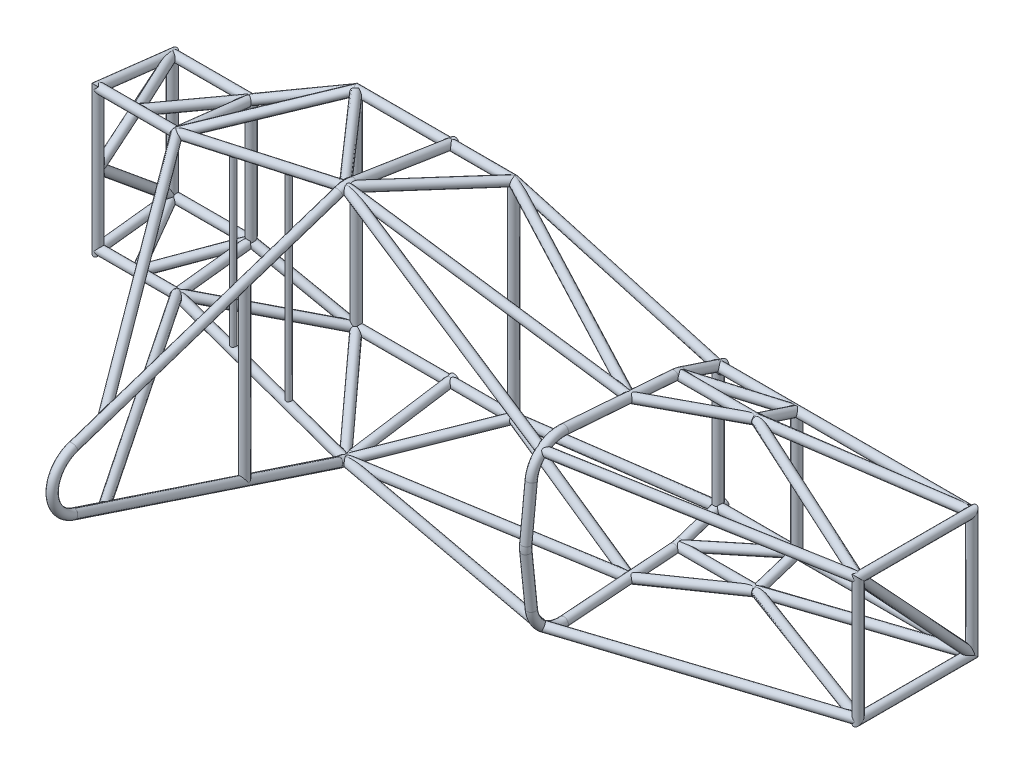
SolidWorks part; units mm, degrees
ref_plane "X-Y Datum" through (0, 0, 0) normal (0, 0, 1) x (1, 0, 0)
ref_plane "X-Z Datum" through (0, 0, 0) normal (0, 1, 0) x (1, 0, 0)
ref_plane "Y-Z Datum" through (0, 0, 0) normal (1, 0, 0) x (0, 0, -1)
sketch "Profile Sketch" plane through (0, 0, 0) normal (0, 1, 0) x (1, 0, 0)
  line L0 (1562.1, -47.625) -> (825.5, -47.625)
  line L1 (0, 0) -> (184.15, 0)
  line L2 (0, 0) -> (-520.9, 0)
  line L3 (-520.9, 0) -> (-520.9, -57.15)
  line L4 (-520.9, -57.15) -> (-749.5, -57.15)
  line L5 (1562.1, -47.625) -> (1562.1, -377.825)
  line L6 (825.5, -47.625) -> (825.5, -606.425)
  line L7 (0, 0) -> (0, -1155.7)
  line L8 (825.5, -47.625) -> (184.15, 0)
  line L9 (1562.1, -377.825) -> (825.5, -561.975)
  line L10 (1054.1, -47.625) -> (1054.1, -165.1)
  line L12 (832.5353, -616.9983) -> (7.0353, -1166.2733) construction
  line L16 (1562.1, -377.825) -> (1054.1, -165.1)
  line L17 (1054.1, -165.1) -> (825.5, -165.1)
  line L19 (-749.5, -57.15) -> (-749.5, -273.05)
  line L20 (567.1583, -41.1762) -> (288.9052, -20.5138) construction
  line L21 (-520.9, -57.15) -> (-520.9, -273.05)
  line L22 (-520.9, -273.05) -> (-749.5, -273.05)
  line L23 (137.3, -527.3369) -> (137.3, -807.3369) construction
  line L24 (425.3148, -130.9186) -> (137.3, -527.3369) construction
  line L25 (425.3148, -130.9186) -> (1337.7014, -200.025) construction
  line L26 (825.5, -304.8) -> (0, -304.8)
  line L27 (825.5, -304.8) -> (184.15, 0)
  line L28 (184.15, 0) -> (0, -304.8)
  line L29 (332.8527, -857.3901) -> (115.1249, -1002.2628) construction
  line L30 (825.5, -561.975) -> (0, -304.8)
  line L31 (0, -304.8) -> (-520.9, -273.05)
  line L32 (0, -304.8) -> (-273.05, 0)
  line L33 (-273.05, 0) -> (-520.9, -273.05)
  line L34 (-520.9, -273.05) -> (-11.0165, -1162.0187) construction
  line L35 (0, -609.6) -> (152.554, -630.3284) construction
  line L36 (55.4543, -966.1263) -> (-75.0666, -738.5664) construction
  line L37 (-520.9, -57.15) -> (-635.2, -273.05)
  line L38 (-635.2, -273.05) -> (-749.5, -57.15)
  line L39 (-520.9, 0) -> (-520.9, -273.05)
  line L40 (1562.1, -47.625) -> (1054.1, -165.1)
  line L41 (1054.1, -165.1) -> (825.5, -304.8)
  line L42 (1054.1, -47.625) -> (825.5, -165.1)
  line L43 (12.7, -1155.7) -> (12.7, 0) construction
  line L44 (0, -1005.7) -> (-520.9, -273.05)
  line L45 (0, -609.6) -> (-18.3492, -607.1068)
  line L46 (0, -609.6) -> (108.7542, -609.6) construction
  line L47 (-12.7, -1155.7) -> (-12.7, 0) construction
  line L48 (1562.1, -157.3) -> (1762.1, -157.3)
  line L49 (1762.1, -157.3) -> (1762.1, -257.3)
  line L50 (1762.1, -257.3) -> (1562.1, -257.3)
  circle A0 centre (184.15, 0) radius 12.7 construction
  circle A1 centre (-273.05, 0) radius 12.7 construction
  circle A2 centre (825.5, -606.425) radius 12.7 construction
  circle A3 centre (0, -1155.7) radius 12.7 construction
  circle A4 centre (137.3, -807.3369) radius 150 construction
  circle A5 centre (137.3, -527.3369) radius 100 construction
  circle A7 centre (425.3148, -130.9186) radius 100 construction
  circle A8 centre (0, -596.9) radius 12.7 construction
  circle A9 centre (-520.9, 0) radius 12.7 construction
  circle A10 centre (0, 0) radius 12.7 construction
  point P24 (171.45, 0)
  point P25 (-260.35, 0)
  point P28 (184.15, 0)
  point P52 (939.8, -165.1)
  point P54 (762.6, -47.625)
  point P55 (184.15, -12.7)
  point P62 (-635.2, -57.15)
  point P65 (1562.1, -157.3)
  point P66 (184.15, 12.7)
  dimension "D9" = 25.4
  dimension "D10" = 25.4
  dimension "D14" = 25.4
  dimension "D15" = 25.4
  dimension "D23" = 300
  dimension "D24" = 200
  dimension "D25" = 200
  dimension "D36" = 596.9
  dimension "D37" = 25.4
  dimension "D39" = 25.4
  dimension "D43" = 200
  dimension "D1" = 736.6
  dimension "D3" = 184.15
  dimension "D5" = 330.2
  dimension "D6" = 558.8
  dimension "D7" = 44.45
  dimension "D8" = 47.625
  dimension "D11" = 228.6
  dimension "D12" = 117.475
  dimension "D13" = 1155.7
  dimension "D16" = 431.8
  dimension "D17" = 57.15
  dimension "D18" = 641.35
  dimension "D19" = 12.7
  dimension "D20" = 1575
  dimension "D21" = 228.6
  dimension "D22" = 273.05
  dimension "D26" = 280
  dimension "D27" = 490
  dimension "D28" = 54
  dimension "D29" = 915
  dimension "D30" = 304.8
  dimension "D31" = 304.8
  dimension "D32" = 76.6683
  dimension "D33" = 150
  dimension "D34" = 155.1234
  dimension "D35" = 7.738
  dimension "D38" = 152.4
  dimension "D40" = 520.9
  dimension "D41" = 170
  dimension "D42" = 35.412
  dimension "D44" = 100
  dimension "D45" = 825.5
ref_plane "Front Bulkhead Plane" through (1562.1, 0, 0) normal (1, 0, 0) x (0, 0, -1)
ref_plane "Front Suspension Plane" through (1054.1, 0, 0) normal (1, 0, 0) x (0, 0, -1)
ref_plane "Front Hoop Plane" through (825.5, 0, 0) normal (1, 0, 0) x (0, 0, -1)
ref_plane "AC Front Tube Plane" through (184.15, 0, 0) normal (1, 0, 0) x (0, 0, -1)
ref_plane "Main Hoop Plane" through (0, 0, 0) normal (1, 0, 0) x (0, 0, -1)
ref_plane "AC Rear Mounting Tube Plane" through (-273.05, 0, 0) normal (1, 0, 0) x (0, 0, -1)
ref_plane "Rear Suspension Plane" through (-520.9, 0, 0) normal (1, 0, 0) x (0, 0, -1)
ref_plane "Rear Bulkhead Plane" through (-749.5, 0, 0) normal (1, 0, 0) x (0, 0, -1)
sketch "Front Bulkhead Sketch" plane through (1562.1, 0, 0) normal (1, 0, 0) x (0, 0, -1)
  line L0 (-47.625, -177.8) -> (-47.625, 177.8)
  line L1 (-47.625, -177.8) -> (-377.825, 177.8)
  line L2 (-377.825, -177.8) -> (-377.825, 177.8)
  line L4 (-47.625, 177.8) -> (-377.825, 177.8)
  line L5 (-47.625, -177.8) -> (-377.825, -177.8)
  line L6 (-47.625, 177.8) -> (-47.625, 193.675)
  line L7 (-377.825, 177.8) -> (-377.825, 193.675)
  line L8 (649.605, 0) -> (-649.605, 0) construction
  line L9 (-47.625, -177.8) -> (-47.625, -193.675)
  line L10 (-377.825, -177.8) -> (-377.825, -193.675)
  point P4 (-47.625, 0)
  point P9 (-377.825, 0)
  dimension "D1" = 355.6
  dimension "D2" = 15.875
  dimension "D3" = 15.875
  dimension "D4" = 330.2
sketch "Front Suspension Sketch" plane through (1054.1, 0, 0) normal (1, 0, 0) x (0, 0, -1)
  line L0 (-47.625, -177.8) -> (-47.625, 177.8)
  line L2 (-47.625, 177.8) -> (-165.1, 215.9)
  line L3 (-47.625, -177.8) -> (-165.1, -215.9)
  point P4 (-47.625, 0)
  dimension "D1" = 355.6
  dimension "D2" = 431.8
  dimension "D3" = 117.475
  dimension "D4" = 72.031
sketch "Front Hoop Sketch" plane through (825.5, 0, 0) normal (1, 0, 0) x (0, 0, -1)
  line L0 (-47.625, -177.8) -> (-47.625, 177.8)
  line L1 (-47.625, 177.8) -> (-154.605, 213.1317)
  line L2 (-47.625, -177.8) -> (-154.605, -213.1317)
  line L3 (-175.8541, 217.3687) -> (-495.1303, 241.2472)
  line L4 (-175.8541, -217.3687) -> (-495.1303, -241.2472)
  line L6 (-590.1899, 161.7303) -> (-605.9544, 9.1356)
  line L8 (-590.1899, -161.7303) -> (-605.9544, -9.1356)
  line L9 (-304.8, -227.0125) -> (-304.8, 227.0125) construction
  line L10 (-165.1, -215.9) -> (-165.1, 215.9) construction
  line L11 (-558.8, -220.7835) -> (-558.8, 220.7835) construction
  line L12 (-47.625, 177.8) -> (-29.536, 171.8258)
  line L13 (-47.625, -177.8) -> (-29.536, -171.8258)
  arc A1 (-154.605, -213.1317) -> (-175.8541, -217.3687) centre (-182.4844, -128.7163) cw
  arc A2 (-154.605, 213.1317) -> (-175.8541, 217.3687) centre (-182.4844, 128.7163) ccw
  arc A5 (-495.1303, 241.2472) -> (-590.1899, 161.7303) centre (-501.7605, 152.5947) ccw
  arc A6 (-605.9544, 9.1356) -> (-605.9544, -9.1356) centre (-517.525, 0) ccw
  arc A7 (-495.1303, -241.2472) -> (-590.1899, -161.7303) centre (-501.7605, -152.5947) cw
  point P4 (-47.625, 0)
  point P13 (-606.425, 0)
  point P17 (-164.9695, -216.5547)
  point P27 (-606.425, 0)
  point P35 (-304.8, 0)
  point P40 (-606.425, 0)
  point P44 (-165.1, 215.9)
  point P46 (-165.1, -215.9)
  dimension "D3" = 88.9
  dimension "D6" = 117.475
  dimension "D10" = 88.9
  dimension "D11" = 454.025
  dimension "D7" = 88.9
  dimension "D2" = 431.8
  dimension "D1" = 355.6
  dimension "D4" = 215.9
  dimension "D5" = 47.625
  dimension "D8" = 19.05
  dimension "D9" = 19.05
  dimension "D12" = 441.567
sketch "AC Front Tube Sketch" plane through (184.15, 0, 0) normal (1, 0, 0) x (0, 0, -1)
  line L0 (0, -298.45) -> (0, 298.45)
  line L1 (0, 298.45) -> (0, 317.5)
  line L2 (0, -298.45) -> (0, -317.5)
  point P4 (0, 0)
  dimension "D1" = 596.9
  dimension "D2" = 19.05
  dimension "D3" = 19.05
sketch "Main Hoop Sketch" plane through (0, 0, 0) normal (1, 0, 0) x (0, 0, -1)
  line L0 (0, -298.45) -> (0, 298.45) construction
  line L1 (-1005.7, 113.8912) -> (-1005.7, -113.8912) construction
  line L2 (-304.8, -346.075) -> (-304.8, 346.075) construction
  line L3 (0, -298.45) -> (12.5478, -296.4894)
  line L4 (0, -298.45) -> (-283.5434, -342.7537)
  line L5 (0, 298.45) -> (-283.5434, 342.7537)
  line L6 (-325.2231, 339.3095) -> (-1094.7555, 84.3902)
  line L8 (0, 298.45) -> (12.5478, 296.4894)
  line L9 (0, 0) -> (-1155.7, 0) construction
  line L10 (-325.2231, -339.3095) -> (-1094.7555, -84.3902)
  line L13 (-596.9, -249.3124) -> (-596.9, 249.3124)
  arc A0 (-1094.7555, 84.3902) -> (-1094.7555, -84.3902) centre (-1066.8, 0) ccw
  arc A1 (-325.2231, -339.3095) -> (-283.5434, -342.7537) centre (-297.2675, -254.9194) ccw
  arc A2 (-325.2231, 339.3095) -> (-283.5434, 342.7537) centre (-297.2675, 254.9194) cw
  point P4 (0, 0)
  point P7 (-304.8, 0)
  point P9 (-304.5887, 343.5174)
  point P15 (-1349.5065, 0)
  point P29 (-1005.7, 0)
  point P30 (-1155.7, 0)
  point P34 (-596.9, 0)
  point P41 (-304.5887, -343.5174)
  dimension "D2" = 692.15
  dimension "D5" = 88.9
  dimension "D7" = 88.9
  dimension "D8" = 88.9
  dimension "D1" = 596.9
  dimension "D3" = 12.7
  dimension "D4" = 12.7
  dimension "D6" = 687.0348
sketch "AC Rear Mounting Sketch" plane through (-273.05, 0, 0) normal (1, 0, 0) x (0, 0, -1)
  line L0 (0, -298.45) -> (0, -317.5) construction
  line L1 (0, 298.45) -> (0, 317.5) construction
  line L2 (0, -298.45) -> (0, 298.45) construction
  line L3 (0, -298.45) -> (0, -317.5)
  line L4 (0, 298.45) -> (0, 317.5)
  line L5 (0, -298.45) -> (0, 298.45)
  point P4 (0, 0)
sketch "Rear Suspension Sketch" plane through (-520.9, 0, 0) normal (1, 0, 0) x (0, 0, -1)
  line L0 (-57.15, -177.8) -> (-57.15, 177.8)
  line L12 (-57.15, -177.8) -> (-273.05, -202.9047)
  line L13 (-57.15, 177.8) -> (-273.05, 202.9047)
  line L14 (-166.37, -190.5) -> (-166.37, 190.5) construction
  line L16 (-273.05, -202.9047) -> (-273.05, 202.9047) construction
  point P0 (-273.05, 0)
  point P4 (-57.15, 0)
  point P25 (-166.37, 0)
  dimension "D2" = 190.5
  dimension "D5" = 83.367
  dimension "D1" = 355.6
  dimension "D8" = 381
  dimension "D9" = 109.22
sketch "Rear Bulkhead Sketch" plane through (-749.5, 0, 0) normal (1, 0, 0) x (0, 0, -1)
  line L0 (-273.05, -202.9047) -> (-273.05, 202.9047) construction
  line L4 (-57.15, -177.8) -> (-57.15, 177.8) construction
  line L11 (-57.15, -177.8) -> (-273.05, -202.9047) construction
  line L13 (-57.15, -177.8) -> (-57.15, 177.8)
  line L16 (-57.15, -177.8) -> (-273.05, 0)
  line L17 (-273.05, 0) -> (-57.15, 177.8)
  line L18 (-57.15, 177.8) -> (-273.05, 202.9047) construction
  line L20 (-273.05, -202.9047) -> (-273.05, 202.9047)
  line L21 (-57.15, -177.8) -> (-273.05, -202.9047)
  line L23 (-57.15, 177.8) -> (-273.05, 202.9047)
sketch3d "3DSketch1"
  line L0 (1562.1, 177.8, 47.625) -> (825.5, 177.8, 47.625)
  line L1 (825.5, -177.8, 47.625) -> (1562.1, -177.8, 47.625)
  line L2 (-273.05, 298.45, 0) -> (-520.9, 177.8, 57.15)
  line L3 (-273.05, -298.45, 0) -> (-520.9, -177.8, 57.15)
  line L4 (1054.1, 215.9, 165.1) -> (825.5, 215.9, 165.1)
  line L5 (1054.1, -215.9, 165.1) -> (1562.1, -177.8, 47.625)
  line L6 (1054.1, -215.9, 165.1) -> (1562.1, -177.8, 377.825)
  line L7 (825.5, -220.7835, 558.8) -> (1562.1, -177.8, 377.825)
  line L8 (825.5, -215.9, 165.1) -> (1054.1, -215.9, 165.1)
  line L9 (1562.1, 177.8, 377.825) -> (825.5, 220.7835, 558.8)
  line L10 (1562.1, 177.8, 47.625) -> (1054.1, 215.9, 165.1)
  line L11 (825.5, -215.9, 165.1) -> (1054.1, -177.8, 47.625)
  line L12 (1054.1, 177.8, 47.625) -> (825.5, 215.9, 165.1)
  line L13 (1562.1, 177.8, 377.825) -> (1054.1, 215.9, 165.1)
  line L14 (825.5, 177.8, 47.625) -> (184.15, 298.45, 0)
  line L15 (184.15, 298.45, 0) -> (0, 298.45, 0)
  line L17 (825.5, 227.0125, 304.8) -> (184.15, 298.45, 0)
  line L19 (184.15, -298.45, 0) -> (825.5, -177.8, 47.625)
  line L20 (0, -298.45, 0) -> (184.15, -298.45, 0)
  line L21 (184.15, -298.45, 0) -> (825.5, -227.0125, 304.8)
  line L24 (184.15, 298.45, 0) -> (0, 343.5174, 304.5887)
  line L25 (825.5, 227.0125, 304.8) -> (0, 343.5174, 304.5887)
  line L26 (825.5, 220.7835, 558.8) -> (0, 343.5174, 304.5887)
  line L27 (0, -343.5174, 304.5887) -> (825.5, -227.0125, 304.8)
  line L28 (184.15, -298.45, 0) -> (0, -343.5174, 304.5887)
  line L29 (0, -343.5174, 304.5887) -> (825.5, -220.7835, 558.8)
  line L30 (0, 298.45, 0) -> (-273.05, 298.45, 0)
  line L31 (-273.05, -298.45, 0) -> (0, -298.45, 0)
  line L32 (-520.9, 202.9047, 273.05) -> (-749.5, 202.9047, 273.05)
  line L33 (-749.5, -202.9047, 273.05) -> (-520.9, -202.9047, 273.05)
  line L34 (0, 343.5174, 304.5887) -> (-520.9, 202.9047, 273.05)
  line L35 (0, -343.5174, 304.5887) -> (-520.9, -202.9047, 273.05)
  line L36 (-520.9, 177.8, 57.15) -> (-749.5, 177.8, 57.15)
  line L37 (0, 343.5174, 304.5887) -> (-273.05, 298.45, 0)
  line L38 (-273.05, 298.45, 0) -> (-520.9, 202.9047, 273.05)
  line L42 (-520.9, -202.9047, 273.05) -> (-273.05, -298.45, 0)
  line L43 (-273.05, -298.45, 0) -> (0, -343.5174, 304.5887)
  line L44 (-749.5, -177.8, 57.15) -> (-520.9, -177.8, 57.15)
  line L45 (-749.5, -177.8, 57.15) -> (-635.2, -202.9047, 273.05)
  line L49 (0, -113.8912, 1005.7) -> (-520.9, -202.9047, 273.05)
  line L50 (1054.1, 215.9, 165.1) -> (825.5, 227.0125, 304.8)
  line L51 (1054.1, -215.9, 165.1) -> (825.5, -227.0125, 304.8)
  line L52 (-175.0354, 296.268, 293.9909) -> (-175.0354, -296.268, 293.9909)
  line L53 (-346.3986, 250.0099, 283.6154) -> (-346.3986, -250.0099, 283.6154)
  line L54 (0, 113.8912, 1005.7) -> (-520.9, 202.9047, 273.05)
  line L55 (-635.2, -202.9047, 273.05) -> (-520.9, -177.8, 57.15)
  line L56 (-520.9, 177.8, 57.15) -> (-635.2, 202.9047, 273.05)
  line L57 (-635.2, 202.9047, 273.05) -> (-749.5, 177.8, 57.15)
  line L58 (-749.5, 202.9047, 273.05) -> (-768.55, 202.9047, 273.05)
  line L59 (-749.5, 177.8, 57.15) -> (-768.55, 177.8, 57.15)
  line L60 (-749.5, -177.8, 57.15) -> (-768.55, -177.8, 57.15)
  line L61 (-749.5, -202.9047, 273.05) -> (-768.55, -202.9047, 273.05)
  line L62 (1562.1, -177.8, 377.825) -> (825.5, 220.7835, 558.8)
  line L64 (-520.9, 177.8, 57.15) -> (-463.75, 177.8, 57.15)
  line L65 (-520.9, -177.8, 57.15) -> (-463.75, -177.8, 57.15)
  line L66 (825.5, -177.8, 47.625) -> (1054.1, 177.8, 47.625)
  line L67 (-273.05, -298.45, 0) -> (-273.05, 298.45, 0)
  point P24 (-175.0354, 296.268, 293.9909)
  point P33 (0, 343.5174, 304.5887)
  point P44 (0, -343.5174, 304.5887)
  point P54 (-346.3986, 250.0099, 283.6154)
  dimension "D1" = 181.61
  dimension "D2" = 177.8
  dimension "D3" = 19.05
  dimension "D4" = 57.15
  dimension "D5" = 57.15
other "Round_tubing 1.00 X 0.095IN(1)"
ref_plane "Plane8" through (825.5, 177.8, 47.625) normal (0, -0.3136, -0.9496) x (0, 0.9496, -0.3136)
sketch "Sketch15" plane through (825.5, 177.8, 47.625) normal (0, -0.3136, -0.9496) x (0, 0.9496, -0.3136)
  circle A0 centre (0, 0) radius 12.7
  circle A1 centre (0, 0) radius 10.287
  point P4 (0, 0)
  dimension "D1" = 25.4
  dimension "D2" = 2.413
other "Round_tubing 1.00 X 0.049IN(22)"
ref_plane "Plane37" through (1562.1, -177.8, 377.825) normal (-0.8597, 0.4652, 0.2112) x (0.3899, 0.3302, 0.8597)
sketch "Sketch152" plane through (1562.1, -177.8, 377.825) normal (-0.8597, 0.4652, 0.2112) x (0.3899, 0.3302, 0.8597)
  circle A0 centre (0, 0) radius 12.7
  circle A1 centre (0, 0) radius 11.4554
  point P4 (0, 0)
  dimension "D1" = 25.4
  dimension "D2" = 1.2446
other "Round_tubing 1.00 X 0.049IN(170)"
ref_plane "Plane52" through (1562.1, 177.8, 377.825) normal (-0.9202, 0.069, -0.3853) x (-0.3776, 0.1033, 0.9202)
sketch "Sketch171" plane through (1562.1, 177.8, 377.825) normal (-0.9202, 0.069, -0.3853) x (-0.3776, 0.1033, 0.9202)
  circle A0 centre (0, 0) radius 12.7
  circle A1 centre (0, 0) radius 11.4554
  point P4 (0, 0)
  dimension "D1" = 25.4
  dimension "D2" = 1.2446
other "Round_tubing 1.00 X 0.049IN(169)"
ref_plane "Plane51" through (1562.1, 177.8, 47.625) normal (-0.9717, 0.0729, 0.2247) x (0.229, 0.0578, 0.9717)
sketch "Sketch170" plane through (1562.1, 177.8, 47.625) normal (-0.9717, 0.0729, 0.2247) x (0.229, 0.0578, 0.9717)
  circle A0 centre (0, 0) radius 12.7
  circle A1 centre (0, 0) radius 11.4554
  point P4 (0, 0)
  dimension "D1" = 25.4
  dimension "D2" = 1.2446
other "Round_tubing 1.00 X 0.065IN(43)"
ref_plane "Plane50" through (1562.1, -177.8, 47.625) normal (0, 1, 0) x (0, 0, 1)
sketch "Sketch169" plane through (1562.1, -177.8, 47.625) normal (0, 1, 0) x (0, 0, 1)
  circle A0 centre (0, 0) radius 12.7
  circle A1 centre (0, 0) radius 11.049
  point P4 (0, 0)
  dimension "D1" = 25.4
  dimension "D2" = 1.651
other "Round_tubing 1.00 X 0.049IN(167)"
ref_plane "Plane49" through (1562.1, -177.8, 47.625) normal (0, 0.7328, 0.6805) x (0, -0.6805, 0.7328)
sketch "Sketch168" plane through (1562.1, -177.8, 47.625) normal (0, 0.7328, 0.6805) x (0, -0.6805, 0.7328)
  circle A0 centre (0, 0) radius 12.7
  circle A1 centre (0, 0) radius 11.4554
  point P4 (0, 0)
  dimension "D1" = 25.4
  dimension "D2" = 1.2446
other "Round_tubing 1.00 X 0.049IN(157)"
ref_plane "Plane48" through (1562.1, 177.8, 47.625) normal (-1, 0, 0) x (0, 0, 1)
sketch "Sketch1" plane through (1562.1, 177.8, 47.625) normal (-1, 0, 0) x (0, 0, 1)
  circle A0 centre (0, 0) radius 12.7
  circle A1 centre (0, 0) radius 11.4554
  point P4 (0, 0)
  dimension "D1" = 25.4
  dimension "D2" = 1.2446
other "Round_tubing 1.00 X 0.049IN(97)"
ref_plane "Plane47" through (1054.1, 177.8, 47.625) normal (0, 0.3085, 0.9512) x (0, -0.9512, 0.3085)
sketch "Sketch167" plane through (1054.1, 177.8, 47.625) normal (0, 0.3085, 0.9512) x (0, -0.9512, 0.3085)
  circle A0 centre (0, 0) radius 12.7
  circle A1 centre (0, 0) radius 11.4554
  point P4 (0, 0)
  point P5 (0, 0)
  dimension "D1" = 25.4
  dimension "D2" = 1.2446
other " C:\\PROGRAM FILES\\SOLIDWORKS CORP\\SOLIDWORKS\\DATA\\WELDMENT PROFILES\\FSAE\\ROUND_TUBING - IS MISSING(1)"
ref_plane "Plane22" through (825.5, 177.8, 47.625) normal (-0.9802, 0.1844, -0.0728) x (-0.0361, 0.1949, 0.9802)
sketch "Sketch123" plane through (825.5, 177.8, 47.625) normal (-0.9802, 0.1844, -0.0728) x (-0.0361, 0.1949, 0.9802)
  circle A0 centre (0, 0) radius 12.7
  circle A1 centre (0, 0) radius 11.049
  point P4 (0, 0)
  dimension "D1" = 25.4
  dimension "D2" = 1.651
other "Round_tubing 1.00 X 0.049IN(6)"
ref_plane "Plane23" through (825.5, 220.7835, 558.8) normal (-0.9462, 0.1407, -0.2914) x (-0.2635, 0.1878, 0.9462)
sketch "Sketch124" plane through (825.5, 220.7835, 558.8) normal (-0.9462, 0.1407, -0.2914) x (-0.2635, 0.1878, 0.9462)
  circle A0 centre (0, 0) radius 12.7
  circle A1 centre (0, 0) radius 11.4554
  point P4 (0, 0)
  dimension "D1" = 25.4
  dimension "D2" = 1.2446
other "Round_tubing 1.00 X 0.095IN(2)"
ref_plane "Plane15" through (0, -249.3124, 596.9) normal (0, 1, 0) x (0, 0, 1)
sketch "Sketch112" plane through (0, -249.3124, 596.9) normal (0, 1, 0) x (0, 0, 1)
  circle A0 centre (0, 0) radius 12.7
  circle A1 centre (0, 0) radius 10.287
  point P4 (0, 0)
  dimension "D1" = 25.4
  dimension "D2" = 2.413
other "Round_tubing_extra ROUND_TUBING_0.625X0.058(1)"
ref_plane "Plane34" through (-175.0354, 296.268, 293.9909) normal (0, -1, 0) x (1, 0, 0)
sketch "Sketch134" plane through (-175.0354, 296.268, 293.9909) normal (0, -1, 0) x (1, 0, 0)
  circle A8 centre (0, 0) radius 7.9375
  circle A9 centre (0, 0) radius 6.4643
  point P0 (0, 0)
  point P4 (0, 0)
  point P6 (0, 0)
  dimension "D1" = 15.875
  dimension "D2" = 1.4732
other "Round_tubing 1.00 X 0.049IN(61)"
ref_plane "Plane38" through (-749.5, 177.8, 57.15) normal (0, 0.1155, 0.9933) x (0, -0.9933, 0.1155)
sketch "Sketch154" plane through (-749.5, 177.8, 57.15) normal (0, 0.1155, 0.9933) x (0, -0.9933, 0.1155)
  circle A0 centre (0, 0) radius 12.7
  circle A1 centre (0, 0) radius 11.4554
  point P4 (0, 0)
  dimension "D1" = 25.4
  dimension "D2" = 1.2446
other "Round_tubing 1.00 X 0.065IN(23)"
ref_plane "Plane39" through (0, 113.8912, 1005.7) normal (-0.5766, 0.0985, -0.811) x (-0.7597, 0.3007, 0.5766)
sketch "Sketch155" plane through (0, 113.8912, 1005.7) normal (-0.5766, 0.0985, -0.811) x (-0.7597, 0.3007, 0.5766)
  circle A0 centre (0, 0) radius 12.7
  circle A1 centre (0, 0) radius 11.049
  point P4 (0, 0)
  dimension "D1" = 25.4
  dimension "D2" = 1.651
other "Round_tubing 1.00 X 0.049IN(63)"
ref_plane "Plane40" through (-273.05, 298.45, 0) normal (-0.6506, -0.2508, 0.7168) x (0.7534, -0.0951, 0.6506)
sketch "Sketch158" plane through (-273.05, 298.45, 0) normal (-0.6506, -0.2508, 0.7168) x (0.7534, -0.0951, 0.6506)
  circle A0 centre (0, 0) radius 12.7
  circle A1 centre (0, 0) radius 11.4554
  point P4 (0, 0)
  point P5 (0, 0)
  dimension "D1" = 25.4
  dimension "D2" = 1.2446
other "Round_tubing 1.00 X 0.065IN(24)"
ref_plane "Plane41" through (0, 343.5174, 304.5887) normal (-0.9638, -0.2602, -0.0584) x (0.0135, -0.2663, 0.9638)
sketch "Sketch159" plane through (0, 343.5174, 304.5887) normal (-0.9638, -0.2602, -0.0584) x (0.0135, -0.2663, 0.9638)
  circle A0 centre (0, 0) radius 12.7
  circle A1 centre (0, 0) radius 11.049
  point P4 (0, 0)
  dimension "D1" = 25.4
  dimension "D2" = 1.651
other "Round_tubing 1.00 X 0.049IN(67)"
ref_plane "Plane43" through (-520.9, 177.8, 57.15) normal (0, 0.1155, 0.9933) x (0, -0.9933, 0.1155)
sketch "Sketch161" plane through (-520.9, 177.8, 57.15) normal (0, 0.1155, 0.9933) x (0, -0.9933, 0.1155)
  circle A0 centre (0, 0) radius 12.7
  circle A1 centre (0, 0) radius 11.4554
  point P4 (0, 0)
  dimension "D1" = 25.4
  dimension "D2" = 1.2446
other "Round_tubing 1.00 X 0.049IN(69)"
ref_plane "Plane44" through (-635.2, -202.9047, 273.05) normal (0.4654, 0.1022, -0.8792) x (-0.7927, -0.3937, -0.4654)
sketch "Sketch162" plane through (-635.2, -202.9047, 273.05) normal (0.4654, 0.1022, -0.8792) x (-0.7927, -0.3937, -0.4654)
  circle A0 centre (0, 0) radius 12.7
  circle A1 centre (0, 0) radius 11.4554
  point P4 (0, 0)
  dimension "D1" = 25.4
  dimension "D2" = 1.2446
other "Al round tubing AL RND TUBE 1 OD X 0.065 WALL(1)"
ref_plane "Plane54" through (-273.05, -298.45, 0) normal (0, 1, 0) x (1, 0, 0)
sketch "Sketch175" plane through (-273.05, -298.45, 0) normal (0, 1, 0) x (1, 0, 0)
  circle A0 centre (0, 0) radius 11.049
  circle A1 centre (0, 0) radius 12.7
  point P3 (0, 0)
  dimension "In_dia" = 22.098
  dimension "Out_dia" = 25.4
other "Round_tubing 1.00 X 0.065IN(25)"
ref_plane "Plane46" through (0, 343.5174, 304.5887) normal (-0.6635, -0.1095, -0.7401) x (-0.694, -0.2796, 0.6635)
sketch "Sketch164" plane through (0, 343.5174, 304.5887) normal (-0.6635, -0.1095, -0.7401) x (-0.694, -0.2796, 0.6635)
  circle A0 centre (0, 0) radius 12.7
  circle A1 centre (0, 0) radius 11.049
  point P4 (0, 0)
  dimension "D1" = 25.4
  dimension "D2" = 1.651
other "Trim/Extend15"
other "Trim/Extend12"
other "Trim/Extend11"
other "Trim/Extend33"
other "Trim/Extend32"
other "Trim/Extend31"
other "Trim/Extend30"
ref_plane "Plane36" [suppressed] through (0, 0, 304.8) normal (0, 0, 1) x (1, 0, 0)
ref_plane "Cockpit Opening Plane" [suppressed] through (0, 0, 304.8) normal (0, 0, 1) x (1, 0, 0)
sketch "Cockpit Opening Sketch" [suppressed] plane through (0, 0, 304.8) normal (0, 0, 1) x (1, 0, 0)
  line L0 (774.7, 200) -> (774.7, -200)
  line L3 (774.7, -200) -> (274.7, -275)
  line L4 (774.7, 200) -> (274.7, 275)
  line L5 (274.7, -275) -> (174.7, -175)
  line L6 (174.7, -175) -> (174.7, 175)
  line L7 (274.7, 275) -> (174.7, 175)
  point P3 (825.5, 0)
  point P4 (774.7, 0)
  point P5 (174.7, 0)
  dimension "D1" = 400
  dimension "D2" = 50.8
  dimension "D3" = 75
  dimension "D4" = 75
  dimension "D5" = 600
  dimension "D6" = 350
  dimension "D7" = 100
  dimension "D8" = 100
extrude "Boss-Extrude3" [suppressed] add sketch "Cockpit Opening Sketch" along normal mid plane 3.175 separate body
ref_plane "Internal Cross Section Plane" [suppressed] through (1337.7014, 0, 0) normal (1, 0, 0) x (0, 0, -1)
sketch "Internal Cross Section Sketch" [suppressed] plane through (1337.7014, 0, 0) normal (1, 0, 0) x (0, 0, -1)
  line L0 (-66.675, -125) -> (-66.675, -50)
  line L3 (-116.675, 175) -> (-366.675, 175)
  line L4 (-116.675, -175) -> (-366.675, -175)
  line L5 (-416.675, -125) -> (-416.675, -50)
  line L6 (-66.675, 50) -> (-66.675, 125)
  line L7 (-241.675, -175) -> (-241.675, 175) construction
  line L8 (-416.675, 50) -> (-416.675, 125)
  line L9 (-66.675, -125) -> (-116.675, -175)
  line L10 (-116.675, 0) -> (-366.675, 0) construction
  line L11 (-66.675, 125) -> (-116.675, 175)
  line L12 (-416.675, 125) -> (-366.675, 175)
  line L13 (-416.675, -125) -> (-366.675, -175)
  arc A0 (-66.675, 50) -> (-66.675, -50) centre (-66.675, 0) ccw
  arc A1 (-416.675, 50) -> (-416.675, -50) centre (-416.675, 0) cw
  point P3 (-66.675, 0)
  dimension "D4" = 100
  dimension "D6" = 50
  dimension "D1" = 19.05
  dimension "D2" = 50
  dimension "D3" = 350
  dimension "D5" = 50
  dimension "D7" = 350
extrude "Boss-Extrude4" [suppressed] add sketch "Internal Cross Section Sketch" along normal mid plane 3.175 separate body
sketch3d "3DSketch2" [suppressed]
  line L0 (1562.1, 177.8, 47.625) -> (1562.1, 193.04, 47.625) construction
  line L1 (1562.1, 177.8, 47.625) -> (1562.1, 177.8, 62.865) construction
  line L2 (1562.1, 177.8, 377.825) -> (1562.1, 192.405, 377.825) construction
  line L3 (1562.1, 177.8, 377.825) -> (1562.1, 177.8, 392.43) construction
  line L4 (1054.1, 177.8, 47.625) -> (1054.1, 193.04, 47.625) construction
  line L5 (1054.1, 177.8, 47.625) -> (1054.1, 177.8, 62.865) construction
  line L6 (1054.1, 215.9, 165.1) -> (1054.1, 240.411, 165.1) construction
  line L7 (1054.1, 215.9, 165.1) -> (1054.1, 215.9, 189.611) construction
  line L8 (825.5, 177.8, 47.625) -> (825.5, 193.04, 47.625) construction
  line L9 (825.5, 177.8, 47.625) -> (825.5, 177.8, 62.865) construction
  line L10 (825.5, 215.9, 165.1) -> (825.5, 231.14, 165.1) construction
  line L11 (825.5, 215.9, 165.1) -> (825.5, 215.9, 180.34) construction
  line L12 (825.5, 227.0125, 304.8) -> (825.5, 241.6175, 304.8) construction
  line L13 (825.5, 227.0125, 304.8) -> (825.5, 227.0125, 319.405) construction
  line L14 (825.5, 222.9012, 558.8) -> (825.5, 240.6812, 558.8) construction
  line L15 (825.5, 222.9012, 558.8) -> (825.5, 222.9012, 576.58) construction
  line L16 (184.15, 298.45, 0) -> (184.15, 313.69, 0) construction
  line L17 (184.15, 298.45, 0) -> (184.15, 298.45, 15.24) construction
  line L18 (0, 343.5174, 304.5887) -> (0, 358.7574, 304.5887) construction
  line L19 (0, 343.5174, 304.5887) -> (0, 343.5174, 319.8287) construction
  line L20 (825.5, 242.0104, 511.0784) -> (825.5, 257.2504, 511.0784)
  line L21 (825.5, 242.0104, 511.0784) -> (810.26, 242.0104, 511.0784)
  circle A0 centre (1562.1, 177.8, 47.625) radius 15.24
  circle A1 centre (1562.1, 177.8, 377.825) radius 14.605
  circle A2 centre (1054.1, 177.8, 47.625) radius 15.24
  circle A3 centre (1054.1, 215.9, 165.1) radius 24.511
  circle A4 centre (825.5, 177.8, 47.625) radius 15.24
  circle A5 centre (825.5, 215.9, 165.1) radius 15.24
  circle A6 centre (825.5, 227.0125, 304.8) radius 14.605
  circle A7 centre (825.5, 222.9012, 558.8) radius 17.78
  circle A8 centre (184.15, 298.45, 0) radius 15.24
  circle A9 centre (0, 343.5174, 304.5887) radius 15.24
  circle A10 centre (825.5, 242.0104, 511.0784) radius 15.24
  point P2 (1577.34, 177.8, 47.625)
  point P8 (1576.705, 177.8, 377.825)
  point P14 (1069.34, 177.8, 47.625)
  point P20 (1078.611, 215.9, 165.1)
  point P26 (840.74, 177.8, 47.625)
  point P32 (840.74, 215.9, 165.1)
  point P38 (840.105, 227.0125, 304.8)
  point P44 (843.28, 222.9012, 558.8)
  point P50 (199.39, 298.45, 0)
  point P56 (15.24, 343.5174, 304.5887)
  point P62 (825.5, 242.0104, 526.3184)
  dimension "D1" = 30.48
  dimension "D2" = 29.21
  dimension "D3" = 30.48
  dimension "D4" = 49.022
  dimension "D5" = 30.48
  dimension "D6" = 30.48
  dimension "D7" = 29.21
  dimension "D8" = 35.56
  dimension "D9" = 30.48
  dimension "D10" = 30.48
  dimension "D11" = 30.48
sketch3d "3DSketch3" [suppressed]
  line L0 (1562.1, 193.04, 47.625) -> (1054.1, 240.411, 165.1)
  line L1 (1054.1, 240.411, 165.1) -> (1054.1, 193.04, 47.625)
  line L2 (1054.1, 193.04, 47.625) -> (1562.1, 193.04, 47.625)
surface "Surface-Fill1" [suppressed] sketch "3DSketch3"
sketch3d "3DSketch4" [suppressed]
  line L0 (1562.1, 193.04, 47.625) -> (1562.1, 192.405, 377.825)
  line L1 (1562.1, 192.405, 377.825) -> (1054.1, 240.411, 165.1)
  line L2 (1054.1, 240.411, 165.1) -> (1562.1, 193.04, 47.625)
surface "Surface-Fill2" [suppressed] sketch "3DSketch4"
sketch3d "3DSketch5" [suppressed]
  line L0 (1054.1, 193.04, 47.625) -> (825.5, 193.04, 47.625)
  line L1 (825.5, 193.04, 47.625) -> (825.5, 231.14, 165.1)
  line L3 (1054.1, 240.411, 165.1) -> (1054.1, 193.04, 47.625)
  line L4 (1054.1, 240.411, 165.1) -> (825.5, 231.14, 165.1)
surface "Surface-Fill3" [suppressed] sketch "3DSketch5"
sketch3d "3DSketch6" [suppressed]
  line L3 (1054.1, 240.411, 165.1) -> (825.5, 231.14, 165.1)
  line L4 (1054.1, 240.411, 165.1) -> (825.5, 241.6175, 304.8)
  line L5 (825.5, 241.6175, 304.8) -> (825.5, 231.14, 165.1)
surface "Surface-Fill4" [suppressed] sketch "3DSketch6"
sketch3d "3DSketch7" [suppressed]
  line L3 (825.5, 241.6175, 304.8) -> (825.5, 257.2504, 511.0784)
  line L6 (1562.1, 192.405, 377.825) -> (1054.1, 240.411, 165.1)
  line L7 (1054.1, 240.411, 165.1) -> (825.5, 241.6175, 304.8)
  line L8 (1562.1, 192.405, 377.825) -> (825.5, 257.2504, 511.0784)
surface "Surface-Fill5" [suppressed] sketch "3DSketch7"
sketch3d "3DSketch8" [suppressed]
  line L0 (825.5, 193.04, 47.625) -> (184.15, 313.69, 0)
  line L1 (184.15, 313.69, 0) -> (825.5, 241.6175, 304.8)
  line L2 (825.5, 241.6175, 304.8) -> (825.5, 231.14, 165.1)
  line L3 (825.5, 231.14, 165.1) -> (825.5, 193.04, 47.625)
surface "Surface-Fill6" [suppressed] sketch "3DSketch8"
sketch3d "3DSketch9" [suppressed]
  line L0 (825.5, 241.6175, 304.8) -> (0, 358.7574, 304.5887)
  line L1 (0, 358.7574, 304.5887) -> (184.15, 313.69, 0)
  line L2 (184.15, 313.69, 0) -> (825.5, 241.6175, 304.8)
surface "Surface-Fill7" [suppressed] sketch "3DSketch9"
sketch3d "3DSketch10" [suppressed]
  line L0 (1562.1, 192.405, 377.825) -> (825.5, 240.6812, 558.8)
  line L1 (1562.1, 192.405, 377.825) -> (825.5, 257.2504, 511.0784)
  arc A0 (825.5, 257.2504, 511.0784) -> (825.5, 240.6812, 558.8) centre (825.5, 168.4448, 506.9819) cw
  point P7 (914.4, 168.4448, 506.9819)
  dimension "D1" = 88.9
surface "Surface-Fill8" [suppressed] sketch "3DSketch10"
sketch3d "3DSketch11" [suppressed]
  line L0 (825.5, 257.2504, 511.0784) -> (0, 358.7574, 304.5887)
  line L1 (0, 358.7574, 304.5887) -> (825.5, 240.6813, 558.8)
  arc A0 (825.5, 257.2504, 511.0784) -> (825.5, 240.6812, 558.8) centre (825.5, 168.4448, 506.9819) ccw construction
  arc A1 (825.5, 257.2504, 511.0784) -> (825.5, 240.6812, 558.8) centre (825.5, 168.4448, 506.9819) ccw
  point P9 (914.4, 168.4448, 506.9819)
  point P11 (914.4, 168.4448, 506.9819)
surface "Surface-Fill9" [suppressed] sketch "3DSketch11"
sketch3d "3DSketch12" [suppressed]
  line L0 (825.5, 241.6175, 304.8) -> (825.5, 257.2504, 511.0784)
  line L1 (825.5, 241.6175, 304.8) -> (0, 358.7574, 304.5887)
  line L2 (0, 358.7574, 304.5887) -> (825.5, 257.2504, 511.0784)
surface "Surface-Fill10" [suppressed] sketch "3DSketch12"
surface "Surface-Knit1" [suppressed]
mirror "Mirror1" [suppressed] about plane through (0, 0, 0) normal (0, 1, 0)
other "Trim/Extend45"
other "Trim/Extend47"
other "Trim/Extend48"
other "Trim/Extend46"
other "Trim/Extend49"
other "Trim/Extend50"
other "Trim/Extend51"
other "Trim/Extend52"
other "Trim/Extend53"
other "Trim/Extend57"
other "Trim/Extend58"
other "Trim/Extend59" [suppressed]
other "Trim/Extend60"
other "Trim/Extend63"
other "Trim/Extend64"
other "Trim/Extend65"
other "Trim/Extend66"
other "Trim/Extend67"
other "Trim/Extend68"
other "Trim/Extend69"
other "Trim/Extend70"
other "Trim/Extend71"
other "Trim/Extend72"
other "Trim/Extend73"
other "Trim/Extend77"
other "Trim/Extend78"
other "Trim/Extend80"
other "Trim/Extend81"
other "Trim/Extend82"
other "Trim/Extend83"
other "Trim/Extend84"
other "Trim/Extend85"
other "Trim/Extend86" [suppressed]
other "Trim/Extend87"
other "Trim/Extend90"
